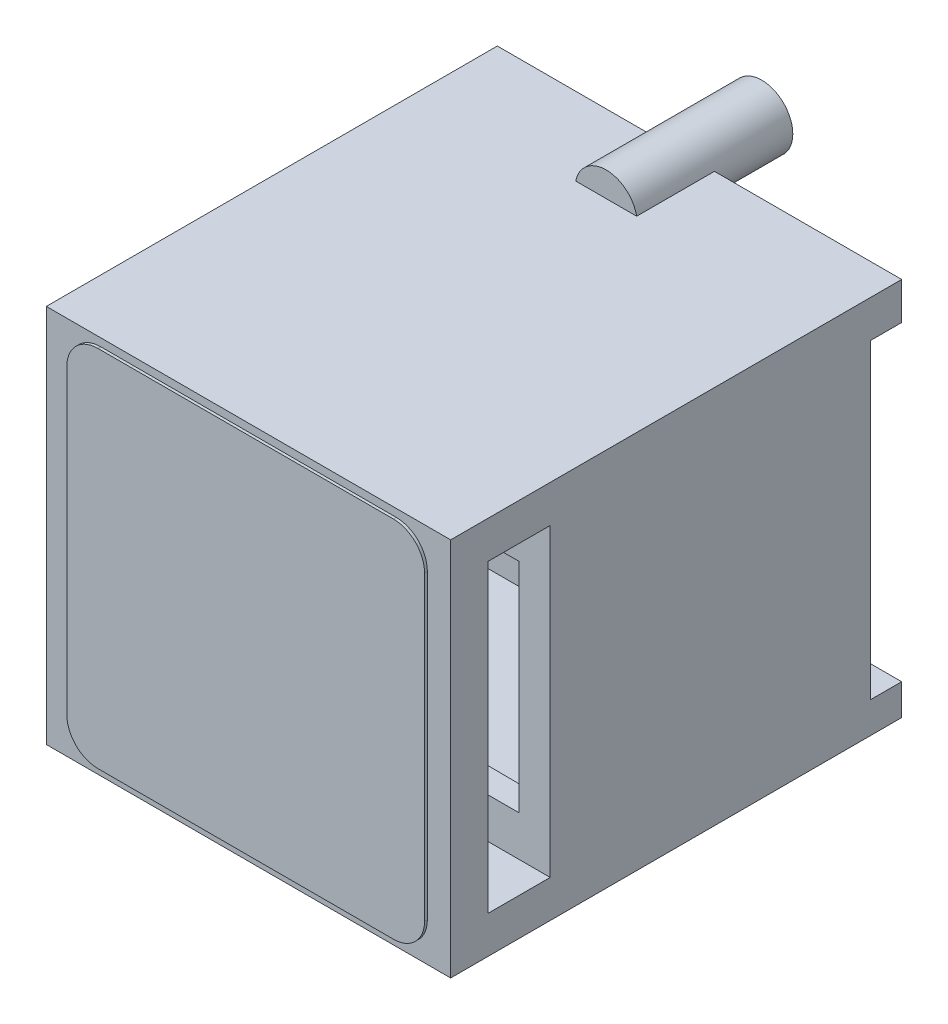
SolidWorks part; units mm, degrees
ref_plane "Plan de face" through (0, 0, 0) normal (0, 0, 1) x (1, 0, 0)
ref_plane "Plan de dessus" through (0, 0, 0) normal (0, 1, 0) x (1, 0, 0)
ref_plane "Plan de droite" through (0, 0, 0) normal (1, 0, 0) x (0, 0, -1)
imported_body "Surface-Importée6"
sketch "Esquisse1" plane through (0, 0, 63.3) normal (0, 0, -1) x (-1, 0, 0)
  line L0 (22.8553, -4.806) -> (28.8553, -4.806) construction
  line L1 (24.6053, 7.144) -> (34.1053, 7.144)
  line L2 (23.6053, 6.144) -> (23.6053, -3.556)
  line L3 (24.6053, -4.556) -> (34.1053, -4.556)
  line L4 (35.1053, 6.144) -> (35.1053, -3.556)
  line L5 (22.8553, 6.194) -> (22.8553, -3.806) construction
  line L7 (28.8755, 7.394) -> (22.8553, 7.394) construction
  line L8 (35.8553, 6.194) -> (35.8553, 4.694) construction
  arc A0 (34.1053, 7.144) -> (35.1053, 6.144) centre (34.1053, 6.144) cw
  arc A1 (34.1053, -4.556) -> (35.1053, -3.556) centre (34.1053, -3.556) ccw
  arc A2 (23.6053, -3.556) -> (24.6053, -4.556) centre (24.6053, -3.556) ccw
  arc A3 (24.6053, 7.144) -> (23.6053, 6.144) centre (24.6053, 6.144) ccw
  dimension "D4" = 1
  dimension "D1" = 0.25
  dimension "D2" = 0.75
  dimension "D3" = 0.75
  dimension "D5" = 0.25
extrude "Boss.-Extru.1" add sketch "Esquisse1" against normal blind 0.09
